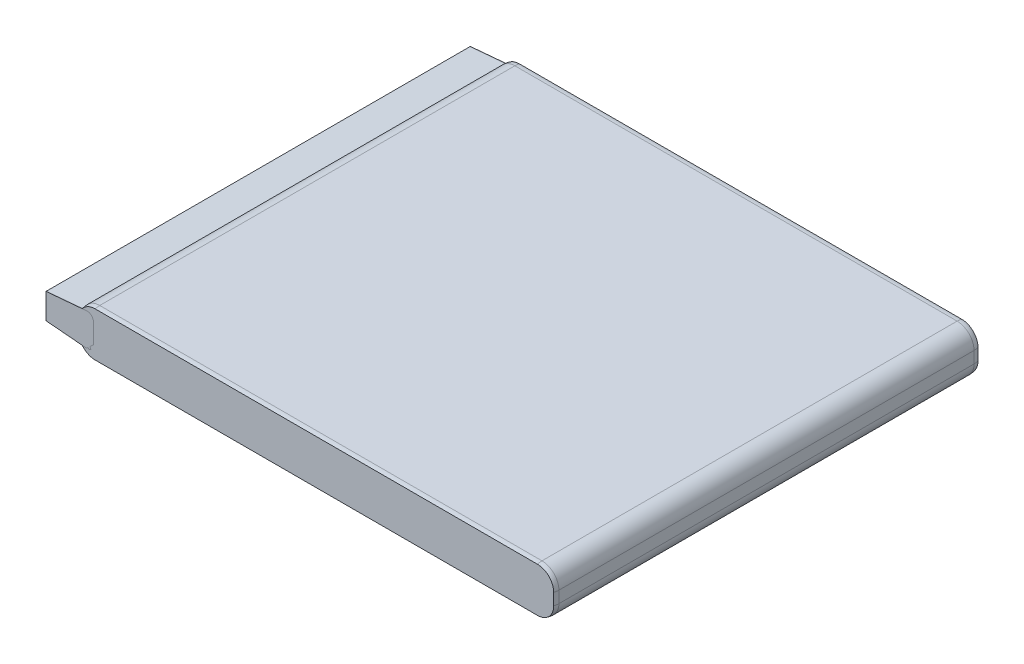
SolidWorks part; units mm, degrees
ref_plane "Front Plane" through (0, 0, 0) normal (0, 0, 1) x (1, 0, 0)
ref_plane "Top Plane" through (0, 0, 0) normal (0, 1, 0) x (1, 0, 0)
ref_plane "Right Plane" through (0, 0, 0) normal (1, 0, 0) x (0, 0, -1)
imported_body "LiPo Battery v5.step"
sketch "Sketch1" plane through (0, 2.69, 0) normal (0, 1, 0) x (1, 0, 0)
  line L0 (0, 25.04) -> (0, -25.04) construction
  line L1 (-38.1922, 27.7235) -> (38.1922, 27.7235)
  line L2 (-38.1922, -25.04) -> (38.1922, -25.04)
  line L3 (-38.1922, -25.04) -> (-38.1922, -27.7235)
  line L4 (-38.1922, -27.7235) -> (38.1922, -27.7235)
  line L5 (38.1922, -25.04) -> (38.1922, -27.7235)
  line L6 (-38.1922, 27.7235) -> (-38.1922, 25.04)
  line L7 (-38.1922, 25.04) -> (38.1922, 25.04)
  line L8 (38.1922, 27.7235) -> (38.1922, 25.04)
  point P10 (0, 0)
  dimension "D1" = 50.08
extrude "Cut-Extrude1" cut sketch "Sketch1" against normal through all both and the other way through all
